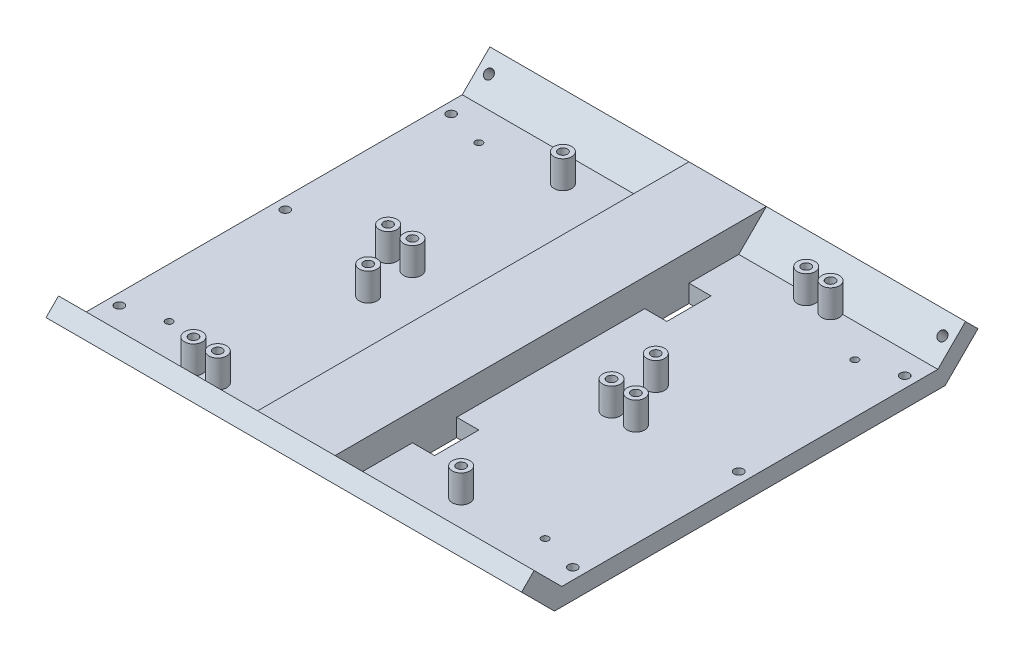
SolidWorks part; units mm, degrees
ref_plane "Front Plane" through (0, 0, 0) normal (0, 0, 1) x (1, 0, 0)
ref_plane "Top Plane" through (0, 0, 0) normal (0, 1, 0) x (1, 0, 0)
ref_plane "Right Plane" through (0, 0, 0) normal (1, 0, 0) x (0, 0, -1)
sketch "Sketch2" plane through (0, 0, 0) normal (1, 0, 0) x (0, 0, -1)
  line L0 (-85, 0) -> (85, 0)
  line L1 (85, 0) -> (97.5, 12.5)
  line L2 (-85, 0) -> (-97.5, 12.5)
  line L8 (-88.3137, -8) -> (-103.1569, 6.8431)
  line L9 (-88.3137, -8) -> (88.3137, -8)
  line L10 (88.3137, -8) -> (103.1569, 6.8431)
  line L11 (-103.1569, 6.8431) -> (-97.5, 12.5)
  line L12 (97.5, 12.5) -> (103.1569, 6.8431)
  line L13 (-97.5, 12.5) -> (-110, 25) construction
  line L14 (97.5, 12.5) -> (110, 25) construction
  point P4 (0, 0)
extrude "Main" add sketch "Sketch2" along normal mid plane 215
hole_wizard "Ø4.0mm Dowel Hole1" positions "3DSketch1" profile "Sketch3" hole size "Ø4.0" standard "ANSI Metric"
sketch3d "3DSketch1"
  line L0 (-107.5, 7.0711, -92.0711) -> (-102.5, 7.0711, -92.0711) construction
  line L1 (-107.5, 12.5, -97.5) -> (-107.5, 0, -85) construction
  line L2 (-102.5, 7.0711, -92.0711) -> (-102.5, 0, -85) construction
  line L3 (107.5, 0, -85) -> (-107.5, 0, -85) construction
  line L4 (-102.5, 0, -85) -> (-102.5, 0, -75) construction
  line L5 (-102.5, 0, -75) -> (-102.5, 0, 0) construction
  line L6 (-102.5, 0, 0) -> (-102.5, 0, 75) construction
  line L7 (-102.5, 0, 75) -> (-102.5, 0, 85) construction
  line L8 (107.5, 0, 85) -> (-107.5, 0, 85) construction
  line L13 (-102.5, 0, 85) -> (-102.5, 7.0711, 92.0711) construction
  line L14 (-102.5, 7.0711, 92.0711) -> (-107.5, 7.0711, 92.0711) construction
  line L15 (-107.5, 0, 85) -> (-107.5, 12.5, 97.5) construction
  line L20 (102.5, 0, -85) -> (102.5, 0, -75) construction
  line L21 (102.5, 0, -75) -> (102.5, 0, 0) construction
  line L22 (102.5, 0, 0) -> (102.5, 0, 75) construction
  line L23 (102.5, 0, 75) -> (102.5, 0, 85) construction
  line L24 (102.5, 0, 85) -> (102.5, 7.0711, 92.0711) construction
  line L25 (102.5, 7.0711, 92.0711) -> (107.5, 7.0711, 92.0711) construction
  line L26 (107.5, 0, 85) -> (107.5, 12.5, 97.5) construction
  line L28 (102.5, 0, -85) -> (102.5, 7.0711, -92.0711) construction
  line L29 (102.5, 7.0711, -92.0711) -> (107.5, 7.0711, -92.0711) construction
  line L30 (107.5, 12.5, -97.5) -> (107.5, 0, -85) construction
  line L32 (107.5, 0, 85) -> (102.5, 0, 85) construction
  line L34 (-102.5, 0, 85) -> (-107.5, 0, 85) construction
  point P0 (-102.5, 7.0711, -92.0711)
  point P2 (-102.5, 0, -75)
  point P4 (-102.5, 0, 0)
  point P6 (-102.5, 0, 75)
  point P8 (-102.5, 7.0711, 92.0711)
  point P10 (102.5, 7.0711, 92.0711)
  point P12 (102.5, 0, 75)
  point P14 (102.5, 0, 0)
  point P16 (102.5, 0, -75)
  point P18 (102.5, 7.0711, -92.0711)
  dimension "D1" = 5
  dimension "D2" = 10
  dimension "D3" = 10
sketch "Sketch3" plane through (-102.5, 7.0711, -92.0711) normal (1, 0, 0) x (0, -0.7071, 0.7071)
  line L0 (0, 0) -> (0, 18.4957)
  line L1 (0, 18.4957) -> (2.05, 18.4957)
  line L2 (2.05, 18.4957) -> (2.05, 0)
  line L5 (2.05, 0) -> (0, 0)
  line L11 (0, -6.35) -> (0, 107.95) construction
  dimension "Thru Hole Dia." = 4.1
  dimension "Thru Hole Depth" = 18.4957
sketch "Sketch4" plane through (0, 0, 0) normal (0, 1, 0) x (1, 0, 0)
  line L0 (0, -85) -> (0, 85) construction
  line L5 (107.5, -85) -> (-107.5, -85) construction
  line L7 (107.5, 85) -> (-107.5, 85) construction
  line L8 (0, 0) -> (107.5, 0) construction
  line L9 (107.5, 85) -> (107.5, -85) construction
  line L11 (17.5, 62.5) -> (27.5, 62.5)
  line L12 (17.5, 62.5) -> (17.5, 42.5)
  line L13 (17.5, 42.5) -> (27.5, 42.5)
  line L14 (27.5, 62.5) -> (27.5, 42.5)
  line L15 (17.5, 62.5) -> (27.5, 42.5) construction
  line L16 (17.5, 42.5) -> (27.5, 62.5) construction
  point P10 (22.5, 52.5)
  dimension "D1" = 20
  dimension "D2" = 10
  dimension "D3" = 35
  dimension "D4" = 125
extrude "Battery strap cutout" cut sketch "Sketch4" against normal through all
mirror "Battery strap cutout mirror" about plane through (0, 0, 0) normal (1, 0, 0) of "Battery strap cutout"
sketch "Sketch6" plane through (0, 0, 0) normal (1, 0, 0) x (0, 0, -1)
  line L0 (-97.5, 12.5) -> (97.5, 12.5)
  line L1 (-85, 0) -> (-97.5, 12.5) construction
  line L2 (97.5, 12.5) -> (85, 0) construction
  line L3 (85, 0) -> (-85, 0) construction
  line L4 (-85, 0) -> (-97.5, 12.5)
  line L5 (85, 0) -> (-85, 0)
  line L6 (97.5, 12.5) -> (85, 0)
extrude "Battery mount" add sketch "Sketch6" along normal mid plane 35
sketch "Sketch7" plane through (0, 12.5, 0) normal (0, 1, 0) x (1, 0, 0)
  line L0 (-61, -15) -> (-50, -15) construction
  line L1 (-61, -15) -> (-61, -83) construction
  line L2 (-61, -83) -> (-50, -83) construction
  line L3 (-50, -15) -> (-50, -83) construction
  line L4 (-61, -15) -> (-50, -83) construction
  line L5 (-61, -83) -> (-50, -15) construction
  line L6 (-61, 73) -> (-50, 73) construction
  line L7 (-61, 73) -> (-61, 5) construction
  line L8 (-61, 5) -> (-50, 5) construction
  line L9 (-50, 73) -> (-50, 5) construction
  line L10 (-61, 73) -> (-50, 5) construction
  line L11 (-61, 5) -> (-50, 73) construction
  line L12 (50, 83) -> (61, 83) construction
  line L13 (50, 83) -> (50, 15) construction
  line L14 (50, 15) -> (61, 15) construction
  line L15 (61, 83) -> (61, 15) construction
  line L16 (50, 83) -> (61, 15) construction
  line L17 (50, 15) -> (61, 83) construction
  line L18 (50, -5) -> (61, -5) construction
  line L19 (50, -5) -> (50, -73) construction
  line L20 (50, -73) -> (61, -73) construction
  line L21 (61, -5) -> (61, -73) construction
  line L22 (50, -5) -> (61, -73) construction
  line L23 (50, -73) -> (61, -5) construction
  circle A0 centre (-50, -15) radius 4
  circle A1 centre (-50, -83) radius 4
  circle A2 centre (-61, -83) radius 4
  circle A3 centre (-50, 73) radius 4
  circle A4 centre (-50, 5) radius 4
  circle A5 centre (-61, 5) radius 4
  circle A6 centre (61, 83) radius 4
  circle A7 centre (50, 83) radius 4
  circle A8 centre (50, 15) radius 4
  circle A9 centre (61, -5) radius 4
  circle A10 centre (50, -5) radius 4
  circle A11 centre (50, -73) radius 4
  point P0 (-55.5, -49)
  point P8 (55.5, 49)
  point P9 (-55.5, 39)
  point P18 (55.5, -39)
  dimension "D3" = 8
  dimension "D1" = 68
  dimension "D2" = 11
  dimension "D4" = 5
  dimension "D5" = 15
  dimension "D6" = 15
  dimension "D7" = 5
  dimension "D8" = 50
  dimension "D9" = 50
extrude "PCB mounts" add sketch "Sketch7" against normal up to surface (12.5 mm away)
sketch "Sketch8" plane through (0, 12.5, 0) normal (0, 1, 0) x (1, 0, 0)
  circle A0 centre (-50, 73) radius 2.05
  circle A1 centre (-50, 5) radius 2.05
  circle A2 centre (-61, 5) radius 2.05
  circle A3 centre (-50, -15) radius 2.05
  circle A4 centre (-61, -83) radius 2.05
  circle A5 centre (-50, -83) radius 2.05
  circle A6 centre (50, -73) radius 2.05
  circle A7 centre (61, -5) radius 2.05
  circle A8 centre (50, -5) radius 2.05
  circle A9 centre (50, 15) radius 2.05
  circle A10 centre (61, 83) radius 2.05
  circle A11 centre (50, 83) radius 2.05
  dimension "D1" = 4.1
extrude "PCB mount inserts" cut sketch "Sketch8" against normal blind 5.7
sketch "Sketch9" plane through (0, -8, 0) normal (0, -1, 0) x (1, 0, 0)
  circle A0 centre (85, 70) radius 1.6
  dimension "D1" = 3.2
  dimension "D2" = 85
  dimension "D3" = 70
extrude "Feet screw hole" cut sketch "Sketch9" against normal through all
mirror "Mirror1" about plane through (0, 0, 0) normal (0, 0, 1) of "Feet screw hole"
equation "\"length\" = 215mm"
equation "\"D1@Main\" = \"length\""
equation "\"width\" = 220mm"
equation "\"height\" = 100mm"
equation "\"skin_th\" = 8mm"
equation "\"D5@Sketch2\"=\"skin_th\""
equation "\"D1@Sketch2\"=\"width\""
